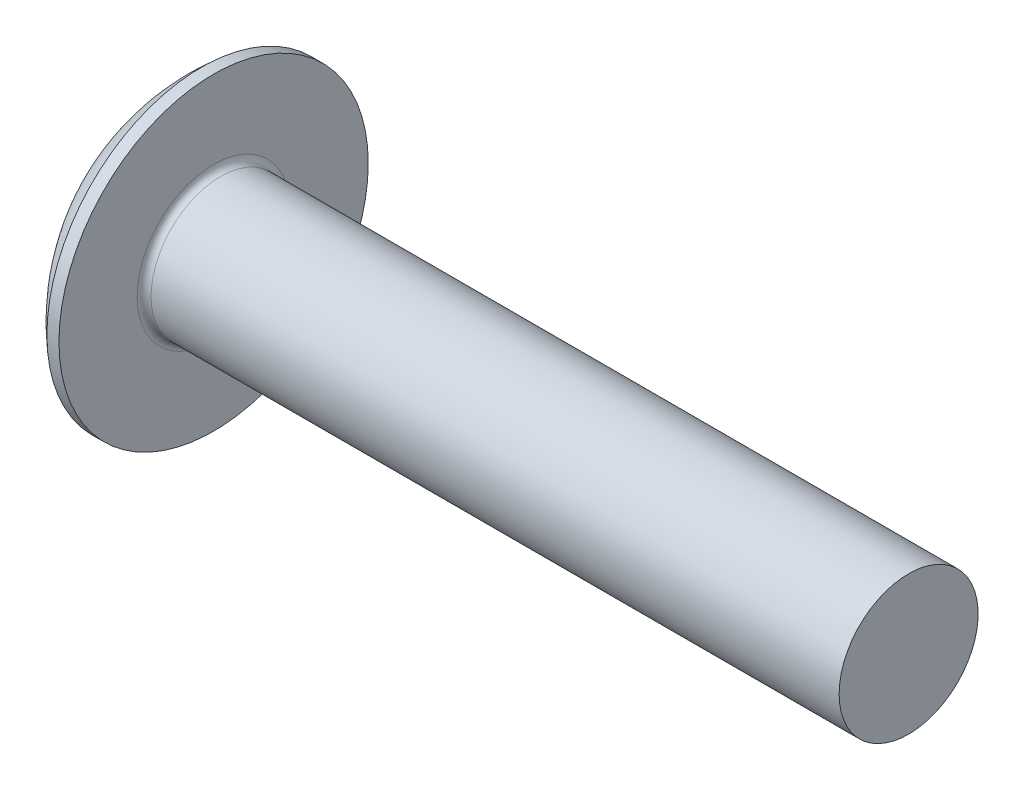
SolidWorks part; units mm, degrees
ref_plane "Front Plane" through (0, 0, 0) normal (0, 0, 1) x (1, 0, 0)
ref_plane "Top Plane" through (0, 0, 0) normal (0, 1, 0) x (1, 0, 0)
ref_plane "Right Plane" through (0, 0, 0) normal (1, 0, 0) x (0, 0, -1)
sketch "BodySke" plane through (0, 0, 0) normal (0, 0, 1) x (1, 0, 0)
  line L0 (0, 0) -> (120.5141, 0) construction
  line L1 (0, 0) -> (0, 50.5629) construction
  line L2 (4.8, 8.9) -> (4.8, 4)
  line L3 (4.8, 4) -> (44.8, 4)
  line L4 (44.8, 4) -> (44.8, 0)
  line L5 (0, 0) -> (44.8, 0)
  line L6 (4.8, 8.9) -> (4.1053, 8.9)
  line L7 (6.05, 10.4217) -> (6.05, -3.1786) construction
  line L8 (14.8, 9.5609) -> (14.8, -6.7938) construction
  arc A0 (0, 0) -> (4.1053, 8.9) centre (11.7, 0) cw
  point P14 (44.8, 3.3095)
  dimension "Head_radius" = 11.7
  dimension "Diameter" = 8
  dimension "Head_height" = 4.8
  dimension "Length" = 40
  dimension "Head_dia" = 17.8
  dimension "Advance" = 1.25
  dimension "Thread_length" = 30
  dimension "Thread_minor" = 6.619
revolve "BaseBody" add sketch "BodySke" angle 360 about L0
fillet "Fillet1" radius 0.4 1 edges at (4.8, 0, 4)
sketch "SlotSke" plane through (0, 0, 0) normal (1, 0, 0) x (0, 0, -1)
  line L1 (8.9, 0.8) -> (-8.9, 0.8)
  line L2 (8.9, 0.8) -> (8.9, -0.8)
  line L3 (8.9, -0.8) -> (-8.9, -0.8)
  line L4 (-8.9, 0.8) -> (-8.9, -0.8)
  dimension "D1" = 17.8
  dimension "D2" = 8.9
  dimension "Slot_width" = 1.6
  dimension "D4" = 0.8
extrude "Slot" cut sketch "SlotSke" along normal blind 2.4
sketch "ThdSchSke" plane through (0, 0, 0) normal (0, 0, 1) x (1, 0, 0)
  line L0 (0, 0) -> (54.7976, 0) construction
  line L1 (44.4013, 4.7973) -> (44.4013, 4)
  line L2 (44.4013, 4.7973) -> (45.1987, 4.7973)
  line L3 (45.1987, 4.7973) -> (45.1987, 4)
  line L4 (45.1987, 4) -> (44.8, 3.3095)
  line L5 (44.8, 3.3095) -> (44.4013, 4)
  line L6 (4.8, 4) -> (44.8, 4) construction
revolve "ThreadSchematic" [suppressed] cut sketch "ThdSchSke" angle 360 about L0
pattern_linear "ThdSchPat" [suppressed] count 24 along (1, 0, 0)
equation "\"Thread_minor@ThreadCosmetic\" = \"Thread_minor@BodySke\""
equation "\"D1@SlotSke\" = \"Head_dia@BodySke\""
equation "\"D2@SlotSke\" = \"D1@SlotSke\" / 2"
equation "\"D4@SlotSke\" = \"Slot_width@SlotSke\" / 2"
equation "\"Advance@ThdSchPat\" = \"Advance@BodySke\""
equation "\"D1@ThdSchPat\" =  int( \"Thread_length@BodySke\" / \"Advance@BodySke\" ) "
